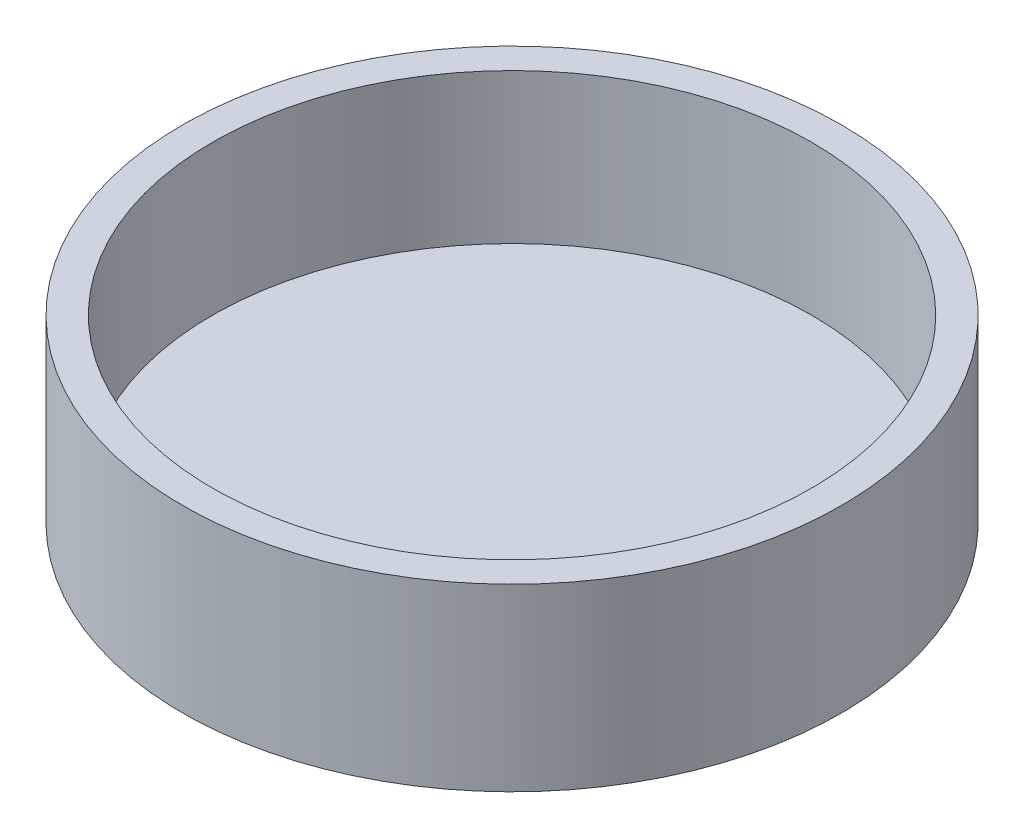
SolidWorks part; units mm, degrees
ref_plane "Front" through (0, 0, 0) normal (0, 0, 1) x (1, 0, 0)
ref_plane "Top" through (0, 0, 0) normal (0, 1, 0) x (1, 0, 0)
ref_plane "Right" through (0, 0, 0) normal (1, 0, 0) x (0, 0, -1)
sketch "Sketch1" plane through (0, 0, 0) normal (0, 0, 1) x (1, 0, 0)
  line L0 (-139.7, 76.2) -> (-139.7, 0)
  line L1 (-139.7, 0) -> (0, 0)
  line L2 (0, 0) -> (0, 12.7)
  line L3 (0, 12.7) -> (-127, 12.7)
  line L4 (-127, 12.7) -> (-127, 76.2)
  line L5 (-127, 76.2) -> (-139.7, 76.2)
  dimension "D1" = 127
  dimension "D2" = 12.7
  dimension "D3" = 12.7
  dimension "D4" = 63.5
revolve "Revolve1" add sketch "Sketch1" angle 360 about L2
